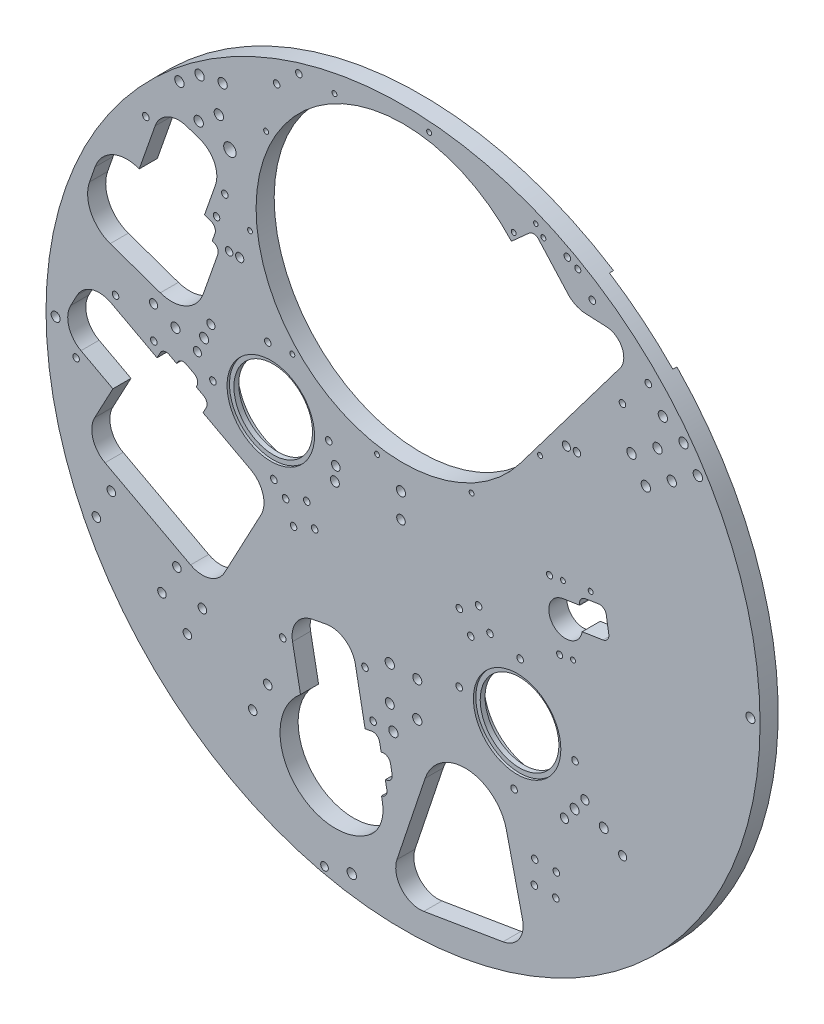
SolidWorks part; units mm, degrees
ref_plane "Front" through (0, 0, 0) normal (0, 0, 1) x (1, 0, 0)
ref_plane "Top" through (0, 0, 0) normal (0, 1, 0) x (1, 0, 0)
ref_plane "Right" through (0, 0, 0) normal (1, 0, 0) x (0, 0, -1)
sketch "Sketch1" plane through (0, 0, 0) normal (0, 0, 1) x (1, 0, 0)
  circle A0 centre (0, 0) radius 187.96
  dimension "D1" = 375.92
extrude ".375 base" add sketch "Sketch1" along normal blind 9.525
sketch "Sketch2" plane through (0, 0, 0) normal (0, 0, -1) x (-1, 0, 0)
  line L0 (0, 102.108) -> (2.8248, 24.7908) construction
  line L1 (-106.6865, 130.8873) -> (-100.7163, 123.4771) construction
  line L2 (-114.2842, 125.1577) -> (-61.7729, 55.5243)
  line L3 (-57.0751, 154.3418) -> (-68.2654, 142.1143)
  line L5 (-107.1075, 140.394) -> (-68.2654, 142.1143)
  arc A0 (-61.7729, 55.5243) -> (-57.0751, 154.3418) centre (0, 102.108) ccw
  arc A3 (-107.1075, 140.394) -> (-114.2842, 125.1577) centre (-106.6865, 130.8873) ccw
  point P3 (2.7877, 25.8061)
  point P13 (-101.3537, 124.2682)
  dimension "D1" = 1.016
  dimension "D3" = 135
  dimension "D4" = 77.3688
  dimension "D5" = 9.516
  dimension "D6" = 102.108
  dimension "D10" = 57.0751
  dimension "D2" = 1.016
  dimension "D7" = 106.6865
  dimension "D8" = 28.7793
  dimension "D9" = 168.8594
  dimension "D11" = 77.3172
  dimension "D12" = 5.3327
extrude "carosel" cut sketch "Sketch2" against normal through all
sketch "Sketch5" plane through (0, 0, 0) normal (0, 0, -1) x (-1, 0, 0)
  circle A0 centre (69.6168, 13.7234) radius 20.701
  circle A2 centre (-60.0464, -64.1854) radius 20.701
  dimension "D1" = 41.402
  dimension "D3" = 69.6168
  dimension "D4" = 13.7234
  dimension "D5" = 60.0464
  dimension "D6" = 64.1854
extrude "heater" cut sketch "Sketch5" against normal through all
sketch "Sketch8" plane through (0, 0, 0) normal (0, 0, -1) x (-1, 0, 0)
  circle A0 centre (69.6168, 13.7234) radius 27.0002
  circle A1 centre (69.6168, 13.7234) radius 20.701 construction
  circle A2 centre (-60.0464, -64.1854) radius 27.0002
  circle A3 centre (-60.0464, -64.1854) radius 20.701 construction
  dimension "D1" = 54.0004
extrude "heater seal" cut sketch "Sketch8" against normal blind 5.715
hole_wizard "#8-32 for heaters" positions "Sketch19" profile "Sketch18" tap size "#8-32" standard "Ansi Inch"
sketch "Sketch19" plane through (0, 0, 9.525) normal (0, 0, 1) x (1, 0, 0)
  line L0 (60.0464, -64.1854) -> (60.0464, -20.8608) construction
  line L2 (60.0464, -64.1854) -> (61.6444, -33.6944) construction
  circle A10 centre (60.0464, -64.1854) radius 27.0002 construction
  point P0 (-100.1078, 12.1254)
  point P1 (-68.0188, -16.7676)
  point P2 (-71.2148, 44.2144)
  point P3 (-39.1258, 15.3214)
  point P10 (29.5554, -62.5874)
  point P11 (58.4485, -94.6764)
  point P14 (90.5374, -65.7834)
  point P15 (61.6444, -33.6944)
  dimension "D1" = 39.1258
  dimension "D2" = 15.3214
  dimension "D3" = 44.2144
  dimension "D4" = 71.2148
  dimension "D5" = 100.1078
  dimension "D6" = 12.1254
  dimension "D7" = 16.7676
  dimension "D8" = 68.0188
  dimension "D9" = 3
  dimension "D10" = 30.5329
  dimension "D11" = 30.491
  dimension "D12" = 1.598
  dimension "D13" = 30.491
  dimension "D14" = 1.598
  dimension "D15" = 30.491
  dimension "D16" = 1.598
sketch "Sketch18" plane through (-100.1078, 12.1254, 9.525) normal (1, 0, 0) x (0, -1, 0)
  line L0 (0, 0) -> (0, 9.525)
  line L1 (0, 9.525) -> (1.7272, 9.525)
  line L2 (1.7272, 9.525) -> (1.7272, 0)
  line L5 (1.7272, 0) -> (0, 0)
  line L11 (0, -6.35) -> (0, 107.95) construction
  dimension "Thru Tap Drill Dia." = 3.4544
  dimension "Thru Tap Drill Depth" = 9.525
sketch "Sketch9" plane through (0, 0, 9.525) normal (0, 0, 1) x (1, 0, 0)
  circle A0 centre (-69.6168, 13.7234) radius 23.0251
  circle A1 centre (-69.6168, 13.7234) radius 20.701 construction
  circle A2 centre (60.0464, -64.1854) radius 23.0251
  circle A3 centre (60.0464, -64.1854) radius 20.701 construction
  dimension "D1" = 46.0502
extrude "Sample heater bore" cut sketch "Sketch9" against normal blind 1.27
hole_wizard "3/16 for clamps" positions "Sketch15" profile "Sketch14" hole size "3/16" standard "Ansi Inch"
sketch "Sketch15" plane through (0, 0, 9.525) normal (0, 0, 1) x (1, 0, 0)
  point P0 (-104.7245, 29.3544)
  point P1 (-119.8109, 26.5067)
  point P6 (90.3338, -87.8485)
  point P7 (105.6609, -88.7352)
  dimension "D1" = 104.7245
  dimension "D2" = 29.3544
  dimension "D3" = 26.5067
  dimension "D4" = 119.8109
  dimension "D5" = 90.3338
  dimension "D6" = 105.6609
  dimension "D7" = 88.7352
  dimension "D8" = 87.8485
sketch "Sketch14" plane through (-104.7245, 29.3544, 9.525) normal (1, 0, 0) x (0, -1, 0)
  line L0 (0, 0) -> (0, 9.525)
  line L1 (0, 9.525) -> (2.3749, 9.525)
  line L2 (2.3749, 9.525) -> (2.3749, 0)
  line L5 (2.3749, 0) -> (0, 0)
  line L11 (0, -6.35) -> (0, 107.95) construction
  dimension "Thru Hole Dia." = 4.7498
  dimension "Thru Hole Depth" = 9.525
hole_wizard "#18 for clamps" positions "Sketch17" profile "Sketch16" hole size "#18" standard "Ansi Inch"
sketch "Sketch17" plane through (0, 0, 9.525) normal (0, 0, 1) x (1, 0, 0)
  point P0 (-101.1706, 37.3366)
  point P1 (-131.3433, 31.6413)
  point P2 (-108.2784, 21.3722)
  point P9 (84.9544, -94.7338)
  point P10 (95.7132, -80.9632)
  point P11 (115.6086, -96.5072)
  dimension "D1" = 101.1706
  dimension "D2" = 108.2784
  dimension "D3" = 131.3433
  dimension "D4" = 37.3366
  dimension "D5" = 21.3722
  dimension "D6" = 31.6413
  dimension "D7" = 84.9544
  dimension "D8" = 95.7132
  dimension "D9" = 115.6086
  dimension "D10" = 80.9632
  dimension "D11" = 94.7338
  dimension "D12" = 96.5072
sketch "Sketch16" plane through (-101.1706, 37.3366, 9.525) normal (1, 0, 0) x (0, -1, 0)
  line L0 (0, 0) -> (0, 9.525)
  line L1 (0, 9.525) -> (2.1526, 9.525)
  line L2 (2.1526, 9.525) -> (2.1526, 0)
  line L5 (2.1526, 0) -> (0, 0)
  line L11 (0, -6.35) -> (0, 107.95) construction
  dimension "Thru Hole Dia." = 4.3053
  dimension "Thru Hole Depth" = 9.525
sketch "Sketch20" plane through (0, 0, 0) normal (0, 0, -1) x (-1, 0, 0)
  circle A0 centre (182.88, 0) radius 2.3749
  circle A2 centre (-182.88, 0) radius 2.3749
  dimension "D1" = 4.7498
  dimension "D5" = 4.7498
  dimension "D4" = 182.88
  dimension "D6" = 182.88
extrude "locating pins - fabrication" cut sketch "Sketch20" against normal through all
sketch "Sketch29" plane through (0, 0, 0) normal (0, 0, -1) x (-1, 0, 0)
  line L0 (-75.6506, 127.7436) -> (-54.1018, 151.676)
  line L1 (-54.1018, 151.676) -> (-68.9675, 165.0611)
  line L2 (-68.9675, 165.0611) -> (-90.5163, 141.1288)
  line L3 (-75.6506, 127.7436) -> (-90.5163, 141.1288)
  line L5 (0, 0) -> (0, 172.265) construction
  line L6 (-68.2654, 142.1143) -> (-107.1075, 140.394) construction
  dimension "D1" = 32.2042
  dimension "D2" = 151.676
  dimension "D3" = 20.0038
  dimension "D4" = 54.1018
extrude "carousel hall sensor" cut sketch "Sketch29" against normal through all
fillet "Fillet3" radius 3.556 1 edges at (68.9675, 165.0611, 4.7625)
hole_wizard "#5-40 Tapped Hole1" positions "Sketch31" profile "Sketch30" tap size "#5-40" standard "Ansi Inch"
sketch "Sketch31" plane through (0, 0, 0) normal (0, 0, -1) x (-1, 0, 0)
  point P0 (-73.8764, 164.3542)
  dimension "D1" = 164.3542
  dimension "D2" = 73.8764
sketch "Sketch30" plane through (73.8764, 164.3542, 0) normal (1, 0, 0) x (0, 1, 0)
  line L0 (0, 0) -> (0, 9.525)
  line L1 (0, 9.525) -> (1.289, 9.525)
  line L2 (1.289, 9.525) -> (1.289, 0)
  line L5 (1.289, 0) -> (0, 0)
  line L11 (0, -6.35) -> (0, 107.95) construction
  dimension "Thru Tap Drill Dia." = 2.5781
  dimension "Thru Tap Drill Depth" = 9.525
hole_wizard "3/32 (0.093750) Diameter Hole1" positions "Sketch33" profile "Sketch32" hole size "3/32" standard "Ansi Inch"
sketch "Sketch33" plane through (0, 0, 0) normal (0, 0, -1) x (-1, 0, 0)
  point P0 (-69.8824, 168.7901)
  dimension "D1" = 69.8824
  dimension "D2" = 168.7901
sketch "Sketch32" plane through (69.8824, 168.7901, 0) normal (1, 0, 0) x (0, 1, 0)
  line L0 (0, 0) -> (0, 9.525)
  line L1 (0, 9.525) -> (1.1913, 9.525)
  line L2 (1.1913, 9.525) -> (1.1913, 0)
  line L5 (1.1913, 0) -> (0, 0)
  line L11 (0, -6.35) -> (0, 107.95) construction
  dimension "Thru Hole Dia." = 2.3825
  dimension "Thru Hole Depth" = 9.525
hole_wizard "#5-40 Tapped Hole2" positions "Sketch39" profile "Sketch38" tap size "#5-40" standard "Ansi Inch"
sketch "Sketch39" plane through (0, 0, 9.525) normal (0, 0, 1) x (1, 0, 0)
  point P0 (36.0788, 29.108)
  point P3 (58.2781, 158.9793)
  point P4 (13.7199, 182.3728)
  point P5 (-36.0788, 175.108)
  point P8 (-13.7199, 21.8432)
  point P9 (-72.0967, 139.9596)
  point P10 (-80.5761, 90.3532)
  point P11 (-58.2781, 45.2367)
  point P12 (72.0967, 64.2564)
  dimension "D1" = 13.7199
  dimension "D2" = 58.2781
  dimension "D3" = 36.0788
  dimension "D4" = 72.0967
  dimension "D5" = 80.5761
  dimension "D6" = 72.0967
  dimension "D7" = 36.0788
  dimension "D8" = 13.7199
  dimension "D9" = 58.2781
  dimension "D10" = 158.9793
  dimension "D11" = 182.3728
  dimension "D12" = 64.2564
  dimension "D13" = 29.108
  dimension "D14" = 21.8432
  dimension "D15" = 45.2367
  dimension "D16" = 90.3532
  dimension "D17" = 139.9596
  dimension "D18" = 175.108
sketch "Sketch38" plane through (36.0788, 29.108, 9.525) normal (1, 0, 0) x (0, -1, 0)
  line L0 (0, 0) -> (0, 9.525)
  line L1 (0, 9.525) -> (1.289, 9.525)
  line L2 (1.289, 9.525) -> (1.289, 0)
  line L5 (1.289, 0) -> (0, 0)
  line L11 (0, -6.35) -> (0, 107.95) construction
  dimension "Thru Tap Drill Dia." = 2.5781
  dimension "Thru Tap Drill Depth" = 9.525
fillet "Fillet6" radius 13.208 1 edges at (90.5163, 141.1288, 4.7625)
sketch "Sketch41" plane through (0, 0, 0) normal (0, 0, -1) x (-1, 0, 0)
  line L0 (-106.6865, 130.8873) -> (-109.7316, 103.0754) construction
  circle A0 centre (-106.6865, 130.8873) radius 27.9781
  point P4 (-109.7274, 103.1133)
  dimension "D2" = 55.9562
  dimension "D5" = 130.8873
  dimension "D1" = 0.0381
  dimension "D3" = 106.6865
  dimension "D4" = 27.8119
extrude "carousel drive" cut sketch "Sketch41" against normal blind 2.159
hole_wizard "#8-32 Tapped Hole2" positions "Sketch43" profile "Sketch42" tap size "#8-32" standard "Ansi Inch"
sketch "Sketch43" plane through (0, 0, 2.159) normal (0, 0, -1) x (-1, 0, 0)
  point P0 (-99.6461, 148.7604)
  point P9 (-129.0854, 125.5098)
  point P10 (-115.5017, 109.6054)
  dimension "D1" = 148.7604
  dimension "D2" = 125.5098
  dimension "D3" = 109.6054
  dimension "D4" = 115.5017
  dimension "D5" = 129.0854
  dimension "D6" = 99.6461
sketch "Sketch42" plane through (99.6461, 148.7604, 2.159) normal (1, 0, 0) x (0, 1, 0)
  line L0 (0, 0) -> (0, 7.366)
  line L1 (0, 7.366) -> (1.7272, 7.366)
  line L2 (1.7272, 7.366) -> (1.7272, 0)
  line L5 (1.7272, 0) -> (0, 0)
  line L11 (0, -6.35) -> (0, 107.95) construction
  dimension "Thru Tap Drill Dia." = 3.4544
  dimension "Thru Tap Drill Depth" = 7.366
hole_wizard "1/8 (0.125000) Diameter Hole1" positions "Sketch45" profile "Sketch44" hole size "1/8" standard "Ansi Inch"
sketch "Sketch45" plane through (0, 0, 0) normal (0, 0, -1) x (-1, 0, 0)
  point P0 (-91.9924, 159.1779)
  dimension "D1" = 91.9924
  dimension "D2" = 159.1779
sketch "Sketch44" plane through (91.9924, 159.1779, 0) normal (1, 0, 0) x (0, 1, 0)
  line L0 (0, 0) -> (0, 9.525)
  line L1 (0, 9.525) -> (1.5837, 9.525)
  line L2 (1.5837, 9.525) -> (1.5837, 0)
  line L5 (1.5837, 0) -> (0, 0)
  line L11 (0, -6.35) -> (0, 107.95) construction
  dimension "Thru Hole Dia." = 3.1674
  dimension "Thru Hole Depth" = 9.525
hole_wizard "#8-32 Tapped Hole3" positions "Sketch47" profile "Sketch46" tap size "#8-32" standard "Ansi Inch"
sketch "Sketch47" plane through (0, 0, 0) normal (0, 0, -1) x (-1, 0, 0)
  point P0 (-86.4987, 161.8352)
  dimension "D1" = 86.4987
  dimension "D2" = 161.8352
sketch "Sketch46" plane through (86.4987, 161.8352, 0) normal (1, 0, 0) x (0, 1, 0)
  line L0 (0, 0) -> (0, 9.525)
  line L1 (0, 9.525) -> (1.7272, 9.525)
  line L2 (1.7272, 9.525) -> (1.7272, 0)
  line L5 (1.7272, 0) -> (0, 0)
  line L11 (0, -6.35) -> (0, 107.95) construction
  dimension "Thru Tap Drill Dia." = 3.4544
  dimension "Thru Tap Drill Depth" = 9.525
hole_wizard "collection rotary valve - TOP" positions "Sketch49" profile "Sketch48" tap size "#8-32" standard "Ansi Inch"
sketch "Sketch49" plane through (0, 0, 9.525) normal (0, 0, 1) x (1, 0, 0)
  point P0 (-86.5559, -109.9422)
  point P1 (-84.4318, -89.7335)
  dimension "D1" = 84.4318
  dimension "D2" = 86.5559
  dimension "D3" = 109.9422
  dimension "D4" = 89.7335
sketch "Sketch48" plane through (-86.5559, -109.9422, 9.525) normal (1, 0, 0) x (0, -1, 0)
  line L0 (0, 0) -> (0, 9.525)
  line L1 (0, 9.525) -> (1.7272, 9.525)
  line L2 (1.7272, 9.525) -> (1.7272, 0)
  line L5 (1.7272, 0) -> (0, 0)
  line L11 (0, -6.35) -> (0, 107.95) construction
  dimension "Thru Tap Drill Dia." = 3.4544
  dimension "Thru Tap Drill Depth" = 9.525
sketch "Sketch50" plane through (0, 0, 0) normal (0, 0, -1) x (-1, 0, 0)
  line L0 (106.8708, 118.8518) -> (113.7025, 121.2459)
  line L2 (130.5354, 113.1494) -> (138.8718, 89.3618)
  line L3 (98.7743, 102.0188) -> (104.5287, 85.5989)
  line L4 (104.5287, 85.5989) -> (101.1728, 84.4228)
  line L5 (98.993, 79.8909) -> (100.421, 75.8159)
  line L6 (100.421, 75.8159) -> (99.7019, 75.5639)
  line L7 (97.5221, 71.0319) -> (105.1245, 49.3385)
  line L8 (0, 0) -> (0, 132.8162) construction
  line L9 (165.0511, 70.3397) -> (162.1309, 78.6727)
  line L10 (139.4711, 89.5718) -> (138.8718, 89.3618)
  line L24 (127.7843, 38.4393) -> (154.152, 47.6799)
  arc A0 (154.152, 47.6799) -> (165.0511, 70.3397) centre (148.2717, 64.4593) ccw
  arc A1 (127.7843, 38.4393) -> (105.1245, 49.3385) centre (121.904, 55.2188) cw
  arc A2 (130.5354, 113.1494) -> (113.7025, 121.2459) centre (118.0707, 108.7812) ccw
  arc A3 (106.8708, 118.8518) -> (98.7743, 102.0188) centre (111.2391, 106.387) ccw
  arc A4 (98.993, 79.8909) -> (101.1728, 84.4228) centre (102.3488, 81.0669) cw
  arc A5 (162.1309, 78.6727) -> (139.4711, 89.5718) centre (145.3514, 72.7923) ccw
  arc A6 (97.5221, 71.0319) -> (99.7019, 75.5639) centre (100.878, 72.208) cw
  circle A10 centre (0, 0) radius 187.96 construction
  dimension "D2" = 13.208
  dimension "D3" = 3.556
  dimension "D12" = 13.208
  dimension "D14" = 82.804
  dimension "D15" = 7.874
  dimension "D13" = 30.607
  dimension "D9" = 17.78
  dimension "D11" = 3.556
  dimension "D7" = 7.62
  dimension "D6" = 33.655
  dimension "D4" = 121.904
  dimension "D5" = 55.2188
  dimension "D8" = 7.112
  dimension "D10" = 11.43
  dimension "D16" = 63.5
  dimension "D17" = 19.313
extrude "Internal Sampler" cut sketch "Sketch50" against normal through all
hole_wizard "#8-32 Tapped Hole (Syringes)" positions "Sketch52" profile "Sketch51" tap size "#8-32" standard "Ansi Inch"
sketch "Sketch52" plane through (0, 0, 0) normal (0, 0, -1) x (-1, 0, 0)
  point P0 (151.3542, 25.516)
  point P1 (131.1888, 14.7486)
  point P2 (63.3203, -86.6623)
  point P3 (93.8184, 100.4166)
  point P4 (135.4074, 114.9914)
  point P5 (15.7468, -100.8545)
  point P6 (20.0328, -78.3999)
  point P7 (172.1113, -13.3585)
  point P19 (98.1866, 87.9518)
  dimension "D1" = 114.9914
  dimension "D2" = 100.4166
  dimension "D3" = 87.9518
  dimension "D4" = 25.516
  dimension "D5" = 14.7486
  dimension "D6" = 13.3585
  dimension "D7" = 172.1113
  dimension "D8" = 131.1888
  dimension "D9" = 151.3542
  dimension "D10" = 98.1866
  dimension "D11" = 93.8184
  dimension "D12" = 135.4074
  dimension "D13" = 78.3999
  dimension "D14" = 100.8545
  dimension "D15" = 86.6623
  dimension "D16" = 20.0328
  dimension "D17" = 15.7468
  dimension "D18" = 63.3203
sketch "Sketch51" plane through (-151.3542, 25.516, 0) normal (1, 0, 0) x (0, 1, 0)
  line L0 (0, 0) -> (0, 9.525)
  line L1 (0, 9.525) -> (1.7272, 9.525)
  line L2 (1.7272, 9.525) -> (1.7272, 0)
  line L5 (1.7272, 0) -> (0, 0)
  line L11 (0, -6.35) -> (0, 107.95) construction
  dimension "Thru Tap Drill Dia." = 3.4544
  dimension "Thru Tap Drill Depth" = 9.525
hole_wizard "#5 C'bore valve mounting" positions "Sketch54" profile "Sketch53" counterbore size "#5" standard "Ansi Inch"
sketch "Sketch54" plane through (0, 0, 0) normal (0, 0, -1) x (-1, 0, 0)
  point P0 (61.7947, -22.4206)
  point P1 (50.6874, -18.0453)
  point P6 (57.6358, -32.9787)
  point P9 (46.5284, -28.6034)
  point P12 (-35.6446, -36.3983)
  point P13 (-29.6312, -26.7749)
  point P14 (-39.7552, -20.4487)
  point P15 (-45.7686, -30.0721)
  point P24 (-80.6667, -121.4168)
  point P25 (-69.3207, -121.2188)
  point P26 (-80.4584, -133.353)
  point P27 (-69.1124, -133.155)
  dimension "D1" = 29.6312
  dimension "D2" = 39.7552
  dimension "D3" = 35.6446
  dimension "D4" = 45.7686
  dimension "D5" = 26.7749
  dimension "D6" = 20.4487
  dimension "D7" = 30.0721
  dimension "D8" = 36.3983
  dimension "D9" = 18.0453
  dimension "D10" = 22.4206
  dimension "D11" = 28.6034
  dimension "D12" = 32.9787
  dimension "D13" = 50.6874
  dimension "D14" = 61.7947
  dimension "D15" = 46.5284
  dimension "D16" = 57.6358
  dimension "D17" = 121.2188
  dimension "D18" = 121.4168
  dimension "D19" = 133.353
  dimension "D20" = 133.155
  dimension "D21" = 69.3207
  dimension "D22" = 69.1124
  dimension "D23" = 80.4584
  dimension "D24" = 80.6667
sketch "Sketch53" plane through (-61.7947, -22.4206, 0) normal (1, 0, 0) x (0, 1, 0)
  line L0 (0, 0) -> (0, 9.525)
  line L1 (0, 9.525) -> (1.7272, 9.525)
  line L3 (1.7272, 9.525) -> (1.7272, 5.08)
  line L4 (1.7272, 5.08) -> (3.175, 5.08)
  line L5 (3.175, 5.08) -> (3.175, 0)
  line L7 (3.175, 0) -> (0, 0)
  line L11 (0, -6.35) -> (0, 107.95) construction
  dimension "Thru Hole Dia." = 3.4544
  dimension "Thru Hole Depth" = 9.525
  dimension "C'Bore Dia." = 6.35
  dimension "C'Bore Depth" = 5.08
hole_wizard "3/16 (0.187500) Diameter Hole2" positions "Sketch56" profile "Sketch55" hole size "3/16" standard "Ansi Inch"
sketch "Sketch56" plane through (0, 0, 9.525) normal (0, 0, 1) x (1, 0, 0)
  point P0 (-6.985, -88.392)
  point P1 (7.493, -70.104)
  dimension "D1" = 70.104
  dimension "D2" = 88.392
  dimension "D3" = 6.985
  dimension "D4" = 7.493
sketch "Sketch55" plane through (-6.985, -88.392, 9.525) normal (1, 0, 0) x (0, -1, 0)
  line L0 (0, 0) -> (0, 9.525)
  line L1 (0, 9.525) -> (2.3749, 9.525)
  line L2 (2.3749, 9.525) -> (2.3749, 0)
  line L5 (2.3749, 0) -> (0, 0)
  line L11 (0, -6.35) -> (0, 107.95) construction
  dimension "Thru Hole Dia." = 4.7498
  dimension "Thru Hole Depth" = 9.525
hole_wizard "#10 (0.193500) Diameter Hole2" positions "Sketch58" profile "Sketch57" hole size "#10" standard "Ansi Inch"
sketch "Sketch58" plane through (0, 0, 9.525) normal (0, 0, 1) x (1, 0, 0)
  point P0 (7.493, -88.392)
  point P1 (-6.985, -70.104)
  dimension "D1" = 6.985
  dimension "D2" = 7.493
  dimension "D3" = 70.104
  dimension "D4" = 88.392
sketch "Sketch57" plane through (7.493, -88.392, 9.525) normal (1, 0, 0) x (0, -1, 0)
  line L0 (0, 0) -> (0, 9.525)
  line L1 (0, 9.525) -> (2.4574, 9.525)
  line L2 (2.4574, 9.525) -> (2.4574, 0)
  line L5 (2.4574, 0) -> (0, 0)
  line L11 (0, -6.35) -> (0, 107.95) construction
  dimension "Thru Hole Dia." = 4.9149
  dimension "Thru Hole Depth" = 9.525
hole_wizard "CBORE for #8 Socket Head Cap Screw1" positions "Sketch60" profile "Sketch59" counterbore size "#8" standard "Ansi Inch"
sketch "Sketch60" plane through (0, 0, 0) normal (0, 0, -1) x (-1, 0, 0)
  point P0 (35.3733, 5.7574)
  point P1 (1.0833, -1.634)
  dimension "D1" = 1.0833
  dimension "D2" = 35.3733
  dimension "D3" = 5.7574
  dimension "D4" = 1.634
sketch "Sketch59" plane through (-35.3733, 5.7574, 0) normal (1, 0, 0) x (0, 1, 0)
  line L0 (0, 0) -> (0, 9.525)
  line L1 (0, 9.525) -> (2.2606, 9.525)
  line L3 (2.2606, 9.525) -> (2.2606, 5.08)
  line L4 (2.2606, 5.08) -> (3.683, 5.08)
  line L5 (3.683, 5.08) -> (3.683, 0)
  line L7 (3.683, 0) -> (0, 0)
  line L11 (0, -6.35) -> (0, 107.95) construction
  dimension "Thru Hole Dia." = 4.5212
  dimension "Thru Hole Depth" = 9.525
  dimension "C'Bore Dia." = 7.366
  dimension "C'Bore Depth" = 5.08
hole_wizard "3/16 (0.187500) Diameter Hole3" positions "Sketch62" profile "Sketch61" hole size "3/16" standard "Ansi Inch"
sketch "Sketch62" plane through (0, 0, 0) normal (0, 0, -1) x (-1, 0, 0)
  point P0 (1.0833, 11.32)
  point P1 (35.894, -1.634)
  dimension "D1" = 11.32
  dimension "D2" = 1.634
  dimension "D3" = 35.894
  dimension "D4" = 1.0833
sketch "Sketch61" plane through (-1.0833, 11.32, 0) normal (1, 0, 0) x (0, 1, 0)
  line L0 (0, 0) -> (0, 9.525)
  line L1 (0, 9.525) -> (2.3749, 9.525)
  line L2 (2.3749, 9.525) -> (2.3749, 0)
  line L5 (2.3749, 0) -> (0, 0)
  line L11 (0, -6.35) -> (0, 107.95) construction
  dimension "Thru Hole Dia." = 4.7498
  dimension "Thru Hole Depth" = 9.525
hole_wizard "#8-32 Tapped Hole5" positions "Sketch64" profile "Sketch63" tap size "#8-32" standard "Ansi Inch"
sketch "Sketch64" plane through (0, 0, 0) normal (0, 0, -1) x (-1, 0, 0)
  point P0 (66.5694, 164.2733)
  point P1 (54.8664, 174.8108)
  dimension "D1" = 174.8108
  dimension "D2" = 164.2733
  dimension "D3" = 66.5694
  dimension "D4" = 54.8664
sketch "Sketch63" plane through (-66.5694, 164.2733, 0) normal (1, 0, 0) x (0, 1, 0)
  line L0 (0, 0) -> (0, 9.525)
  line L1 (0, 9.525) -> (1.7272, 9.525)
  line L2 (1.7272, 9.525) -> (1.7272, 0)
  line L5 (1.7272, 0) -> (0, 0)
  line L11 (0, -6.35) -> (0, 107.95) construction
  dimension "Thru Tap Drill Dia." = 3.4544
  dimension "Thru Tap Drill Depth" = 9.525
hole_wizard "#18 (0.169500) Diameter Hole4" positions "Sketch66" profile "Sketch65" hole size "#18" standard "Ansi Inch"
sketch "Sketch66" plane through (0, 0, 0) normal (0, 0, -1) x (-1, 0, 0)
  point P0 (85.979, 75.438)
  point P1 (-85.979, 75.438)
  point P14 (-11.7545, -2.621)
  dimension "D1" = 85.979
  dimension "D2" = 85.979
  dimension "D3" = 75.438
  dimension "D4" = 75.438
sketch "Sketch65" plane through (-85.979, 75.438, 0) normal (1, 0, 0) x (0, 1, 0)
  line L0 (0, 0) -> (0, 9.525)
  line L1 (0, 9.525) -> (2.1526, 9.525)
  line L2 (2.1526, 9.525) -> (2.1526, 0)
  line L5 (2.1526, 0) -> (0, 0)
  line L11 (0, -6.35) -> (0, 107.95) construction
  dimension "Thru Hole Dia." = 4.3053
  dimension "Thru Hole Depth" = 9.525
hole_wizard "5/32 (0.156250) Diameter Hole1" positions "Sketch68" profile "Sketch67" hole size "5/32" standard "Ansi Inch"
sketch "Sketch68" plane through (0, 0, 0) normal (0, 0, -1) x (-1, 0, 0)
  point P0 (-91.567, 75.438)
  point P1 (91.567, 75.438)
  point P12 (-91.6974, -47.5768)
  dimension "D1" = 91.567
  dimension "D2" = 91.567
  dimension "D3" = 75.438
  dimension "D4" = 75.438
sketch "Sketch67" plane through (91.567, 75.438, 0) normal (1, 0, 0) x (0, 1, 0)
  line L0 (0, 0) -> (0, 9.525)
  line L1 (0, 9.525) -> (1.9812, 9.525)
  line L2 (1.9812, 9.525) -> (1.9812, 0)
  line L5 (1.9812, 0) -> (0, 0)
  line L11 (0, -6.35) -> (0, 107.95) construction
  dimension "Thru Hole Dia." = 3.9624
  dimension "Thru Hole Depth" = 9.525
hole_wizard "#10 (0.1935) Diameter Hole1" positions "Sketch70" profile "Sketch69" hole size "#10" standard "Ansi Inch"
sketch "Sketch70" plane through (0, 0, 0) normal (0, 0, -1) x (-1, 0, 0)
  point P0 (-136.7718, 114.3708)
  point P1 (94.994, 150.3643)
  dimension "D1" = 136.7718
  dimension "D2" = 114.3708
  dimension "D3" = 150.3643
  dimension "D4" = 94.994
sketch "Sketch69" plane through (136.7718, 114.3708, 0) normal (1, 0, 0) x (0, 1, 0)
  line L0 (0, 0) -> (0, 9.525)
  line L1 (0, 9.525) -> (2.4574, 9.525)
  line L2 (2.4574, 9.525) -> (2.4574, 0)
  line L5 (2.4574, 0) -> (0, 0)
  line L11 (0, -6.35) -> (0, 107.95) construction
  dimension "Thru Hole Dia." = 4.9149
  dimension "Thru Hole Depth" = 9.525
hole_wizard "CBORE for #8 Socket Head Cap Screw2" positions "Sketch72" profile "Sketch71" counterbore size "#8" standard "Ansi Inch"
sketch "Sketch72" plane through (0, 0, 0) normal (0, 0, -1) x (-1, 0, 0)
  point P0 (79.1247, -127.4885)
  point P1 (71.2052, -111.8539)
  point P2 (105.6466, -94.4078)
  point P3 (113.5662, -110.0424)
  point P4 (119.0719, -82.2125)
  point P5 (126.9198, -97.8832)
  point P6 (161.4408, -80.595)
  point P7 (153.5929, -64.9243)
  dimension "D1" = 71.2052
  dimension "D2" = 79.1247
  dimension "D3" = 105.6466
  dimension "D4" = 113.5662
  dimension "D5" = 119.0719
  dimension "D6" = 126.9198
  dimension "D7" = 161.4408
  dimension "D8" = 153.5929
  dimension "D9" = 64.9243
  dimension "D10" = 80.595
  dimension "D11" = 82.2125
  dimension "D12" = 97.8832
  dimension "D13" = 94.4078
  dimension "D14" = 110.0424
  dimension "D15" = 111.8539
  dimension "D16" = 127.4885
sketch "Sketch71" plane through (-79.1247, -127.4885, 0) normal (1, 0, 0) x (0, 1, 0)
  line L0 (0, 0) -> (0, 9.525)
  line L1 (0, 9.525) -> (2.2479, 9.525)
  line L3 (2.2479, 9.525) -> (2.2479, 5.842)
  line L4 (2.2479, 5.842) -> (3.9687, 5.842)
  line L5 (3.9687, 5.842) -> (3.9687, 0)
  line L7 (3.9687, 0) -> (0, 0)
  line L11 (0, -6.35) -> (0, 107.95) construction
  dimension "Thru Hole Dia." = 4.4958
  dimension "Thru Hole Depth" = 9.525
  dimension "C'Bore Dia." = 7.9375
  dimension "C'Bore Depth" = 5.842
hole_wizard "#10 (0.1935) Diameter Hole2" positions "Sketch74" profile "Sketch73" hole size "#10" standard "Ansi Inch"
sketch "Sketch74" plane through (0, 0, 0) normal (0, 0, -1) x (-1, 0, 0)
  point P0 (5.0678, -100.3389)
  dimension "D1" = 100.3389
  dimension "D2" = 5.0678
sketch "Sketch73" plane through (-5.0678, -100.3389, 0) normal (1, 0, 0) x (0, 1, 0)
  line L0 (0, 0) -> (0, 9.525)
  line L1 (0, 9.525) -> (2.4574, 9.525)
  line L2 (2.4574, 9.525) -> (2.4574, 0)
  line L5 (2.4574, 0) -> (0, 0)
  line L11 (0, -6.35) -> (0, 107.95) construction
  dimension "Thru Hole Dia." = 4.9149
  dimension "Thru Hole Depth" = 9.525
sketch "Sketch77" plane through (0, 0, 0) normal (0, 0, -1) x (-1, 0, 0)
  line L0 (-93.0087, 6.3956) -> (-92.9491, 6.772)
  line L1 (-93.0087, 6.3956) -> (-84.1669, 4.9952)
  line L3 (-105.344, -3.2917) -> (-94.2745, -5.0449)
  line L4 (-95.905, 10.8405) -> (-102.9294, 11.953)
  line L6 (-108.2999, 0.7768) -> (-106.9979, 8.9971)
  line L9 (0, 0) -> (-64.3755, 0) construction
  arc A0 (-94.2745, -5.0449) -> (-84.1669, 4.9952) centre (-85.5476, -3.7226) ccw
  arc A2 (-102.9294, 11.953) -> (-106.9979, 8.9971) centre (-103.4857, 8.4408) ccw
  arc A3 (-105.344, -3.2917) -> (-108.2999, 0.7768) centre (-104.7877, 0.2206) cw
  arc A4 (-92.9491, 6.772) -> (-95.905, 10.8405) centre (-96.4613, 7.3282) ccw
  dimension "D1" = 9
  dimension "D3" = 3.556
  dimension "D4" = 3.556
  dimension "D9" = 8.8265
  dimension "D6" = 23.176
  dimension "D2" = 85.5476
  dimension "D5" = 0.381
  dimension "D7" = 7.112
  dimension "D8" = 3.7226
  dimension "D10" = 11.4977
  dimension "D11" = 64.3755
extrude "flush puck holder" cut sketch "Sketch77" against normal through all
hole_wizard "#5-40 Tapped Hole3" positions "Sketch79" profile "Sketch78" tap size "#5-40" standard "Ansi Inch"
sketch "Sketch79" plane through (0, 0, 0) normal (0, 0, -1) x (-1, 0, 0)
  point P0 (-89.4642, -20.3324)
  point P1 (-84.1398, 13.2846)
  point P2 (-98.7517, 15.5989)
  dimension "D1" = 84.1398
  dimension "D2" = 98.7517
  dimension "D3" = 89.4642
  dimension "D4" = 20.3324
  dimension "D5" = 13.2846
  dimension "D6" = 15.5989
sketch "Sketch78" plane through (89.4642, -20.3324, 0) normal (1, 0, 0) x (0, 1, 0)
  line L0 (0, 0) -> (0, 9.525)
  line L1 (0, 9.525) -> (1.289, 9.525)
  line L2 (1.289, 9.525) -> (1.289, 0)
  line L5 (1.289, 0) -> (0, 0)
  line L11 (0, -6.35) -> (0, 107.95) construction
  dimension "Thru Tap Drill Dia." = 2.5781
  dimension "Thru Tap Drill Depth" = 9.525
hole_wizard "1/8 (0.125) Diameter Hole1" positions "Sketch81" profile "Sketch80" hole size "1/8" standard "Ansi Inch"
sketch "Sketch81" plane through (0, 0, 0) normal (0, 0, -1) x (-1, 0, 0)
  point P0 (-82.4398, -21.445)
  point P1 (-77.1154, 12.172)
  dimension "D1" = 77.1154
  dimension "D2" = 82.4398
  dimension "D3" = 21.445
  dimension "D4" = 12.172
sketch "Sketch80" plane through (82.4398, -21.445, 0) normal (1, 0, 0) x (0, 1, 0)
  line L0 (0, 0) -> (0, 9.525)
  line L1 (0, 9.525) -> (1.5837, 9.525)
  line L2 (1.5837, 9.525) -> (1.5837, 0)
  line L5 (1.5837, 0) -> (0, 0)
  line L11 (0, -6.35) -> (0, 107.95) construction
  dimension "Thru Hole Dia." = 3.1674
  dimension "Thru Hole Depth" = 9.525
sketch "Sketch87" plane through (0, 0, 0) normal (0, 0, -1) x (-1, 0, 0)
  line L0 (19.9805, -106.4464) -> (25.1236, -79.5009)
  line L1 (40.5738, -69.0034) -> (47.6844, -70.3607)
  line L2 (58.1818, -85.8108) -> (53.98, -107.8249)
  line L3 (19.9805, -106.4464) -> (16.4876, -105.7797)
  line L4 (6.6102, -115.5308) -> (5.753, -120.0217)
  line L6 (10.7699, -112.7045) -> (11.5183, -112.8474)
  line L7 (11.5183, -112.8474) -> (12.3279, -108.606)
  line L8 (8.5793, -124.1813) -> (9.3277, -124.3242)
  line L9 (9.3277, -124.3242) -> (8.5182, -128.5656)
  line L11 (11.3444, -132.7253) -> (10.8682, -135.2202)
  line L14 (0, 0) -> (0, -202.9001) construction
  arc A0 (18.2373, -154.0139) -> (53.98, -107.8249) centre (35.56, -130.4948) ccw
  arc A1 (40.5738, -69.0034) -> (25.1236, -79.5009) centre (38.0974, -81.9772) ccw
  arc A2 (8.5182, -128.5656) -> (11.3444, -132.7253) centre (12.0111, -129.2323) ccw
  arc A3 (16.4876, -105.7797) -> (12.3279, -108.606) centre (15.8209, -109.2727) ccw
  arc A4 (5.753, -120.0217) -> (8.5793, -124.1813) centre (9.246, -120.6884) ccw
  arc A5 (10.7699, -112.7045) -> (6.6102, -115.5308) centre (10.1031, -116.1975) ccw
  arc A6 (58.1818, -85.8108) -> (47.6844, -70.3607) centre (45.2081, -83.3344) ccw
  arc A7 (18.2373, -154.0139) -> (10.8682, -135.2202) centre (29.4651, -138.7699) cw
  point P26 (6.1816, -117.7762)
  dimension "D1" = 3.556
  dimension "D2" = 13.208
  dimension "D5" = 29.21
  dimension "D9" = 7.874
  dimension "D7" = 130.4948
  dimension "D3" = 27.432
  dimension "D4" = 33.655
  dimension "D6" = 11.43
  dimension "D8" = 40.64
  dimension "D10" = 10.806
  dimension "D11" = 35.56
  dimension "D12" = 7.112
  dimension "D13" = 11.684
  dimension "D14" = 38.0974
  dimension "D15" = 69.0034
  dimension "D17" = 2.54
extrude "processing syringe" cut sketch "Sketch87" against normal through all
sketch "Sketch88" plane through (0, 0, 0) normal (0, 0, -1) x (-1, 0, 0)
  line L0 (-11.644, -113.1652) -> (3.204, -157.6629)
  line L1 (-10.9376, -174.2088) -> (-52.615, -167.2395)
  line L2 (-62.8911, -151.8404) -> (-54.3751, -115.1721)
  arc A0 (-134.6635, 131.1285) -> (-101.2815, 158.3383) centre (0, 0) ccw construction
  arc A1 (-11.644, -113.1652) -> (-54.3751, -115.1721) centre (-32.7263, -120.1999) ccw
  arc A2 (-52.615, -167.2395) -> (-62.8911, -151.8404) centre (-50.5204, -154.7134) cw
  arc A3 (3.204, -157.6629) -> (-10.9376, -174.2088) centre (-8.843, -161.6827) cw
  point P14 (-66.4068, -164.9333)
  point P17 (10.5382, -177.8)
  dimension "D1" = 120.1999
  dimension "D3" = 10.16
  dimension "D5" = 12.7
  dimension "D4" = 32.7263
  dimension "D9" = 50.5204
  dimension "D10" = 22.225
  dimension "D2" = 10.16
  dimension "D6" = 161.6827
  dimension "D7" = 8.843
  dimension "D8" = 154.7134
extrude "precious reagent valve" cut sketch "Sketch88" against normal through all
sketch "Sketch40" plane through (0, 0, 0) normal (0, 0, -1) x (-1, 0, 0)
  line L0 (153.6948, 20.8629) -> (129.4963, 7.9421)
  line L1 (171.567, 15.4329) -> (174.9767, 9.0472)
  line L2 (169.5467, -8.8251) -> (152.7422, -17.7978)
  line L3 (119.2006, 10.5071) -> (123.0096, 12.5409)
  line L5 (114.0299, 12.6412) -> (109.9968, 10.4877)
  line L6 (103.6229, -1.8418) -> (105.2978, -4.9787)
  line L8 (127.8214, 11.079) -> (129.4963, 7.9421)
  line L12 (119.2006, 10.5071) -> (118.8417, 11.1792)
  line L13 (108.5349, 5.6759) -> (108.8938, 5.0038)
  line L14 (108.8938, 5.0038) -> (105.0848, 2.9699)
  line L15 (152.7422, -17.7978) -> (162.3131, -35.7226)
  line L17 (105.2978, -4.9787) -> (80.203, -18.378)
  line L25 (156.8831, -53.5949) -> (111.847, -77.6419)
  line L26 (74.773, -36.2503) -> (93.9748, -72.2119)
  arc A0 (103.6229, -1.8418) -> (105.0848, 2.9699) centre (106.7597, -0.1669) cw
  arc A1 (74.773, -36.2503) -> (80.203, -18.378) centre (86.4241, -30.0291) cw
  arc A2 (171.567, 15.4329) -> (153.6948, 20.8629) centre (159.9159, 9.2118) ccw
  arc A3 (114.0299, 12.6412) -> (118.8417, 11.1792) centre (115.7048, 9.5043) cw
  arc A4 (127.8214, 11.079) -> (123.0096, 12.5409) centre (124.6845, 9.4041) ccw
  arc A5 (109.9968, 10.4877) -> (108.5349, 5.6759) centre (111.6717, 7.3509) ccw
  arc A7 (169.5467, -8.8251) -> (174.9767, 9.0472) centre (163.3256, 2.8261) ccw
  arc A12 (111.847, -77.6419) -> (93.9748, -72.2119) centre (105.6259, -65.9908) cw
  arc A13 (156.8831, -53.5949) -> (162.3131, -35.7226) centre (150.662, -41.9438) ccw
  point P44 (112.0134, 11.5644)
  dimension "D8" = 153.6948
  dimension "D10" = 3.556
  dimension "D11" = 11.684
  dimension "D13" = 27.432
  dimension "D16" = 13.208
  dimension "D20" = 33.528
  dimension "D24" = 13.208
  dimension "D12" = 3.556
  dimension "D6" = 3.556
  dimension "D25" = 13.208
  dimension "D7" = 13.208
  dimension "D9" = 3.556
  dimension "D5" = 11.43
  dimension "D15" = 13.208
  dimension "D3" = 67.183
  dimension "D4" = 7.112
  dimension "D14" = 86.4241
  dimension "D17" = 30.0291
  dimension "D18" = 41.656
  dimension "D21" = 32.258
  dimension "D22" = 77.47
extrude "Collection syringe" cut sketch "Sketch40" against normal through all
hole_wizard "#10 (0.1935) Diameter Hole3" positions "Sketch90" profile "Sketch89" hole size "#10" standard "Ansi Inch"
sketch "Sketch90" plane through (0, 0, 9.525) normal (0, 0, 1) x (1, 0, 0)
  point P3 (155.1677, 96.5429)
  point P4 (147.6399, 107.7034)
  point P5 (141.4803, 87.3106)
  point P6 (133.9525, 98.4711)
  point P7 (127.7929, 78.0784)
  point P8 (120.2651, 89.2389)
  point P12 (-117.7399, 139.7672)
  point P13 (-107.5753, 126.7572)
  point P14 (-107.1317, 148.0553)
  point P15 (-96.9671, 135.0452)
  dimension "D1" = 120.2651
  dimension "D2" = 133.9525
  dimension "D3" = 147.6399
  dimension "D4" = 127.7929
  dimension "D5" = 141.4803
  dimension "D6" = 155.1677
  dimension "D7" = 78.0784
  dimension "D8" = 87.3106
  dimension "D9" = 96.5429
  dimension "D10" = 89.2389
  dimension "D11" = 98.4711
  dimension "D12" = 107.7034
  dimension "D13" = 107.5753
  dimension "D14" = 96.9671
  dimension "D15" = 107.1317
  dimension "D16" = 117.7399
  dimension "D17" = 139.7672
  dimension "D18" = 126.7572
  dimension "D19" = 148.0553
  dimension "D20" = 135.0452
sketch "Sketch89" plane through (155.1677, 96.5429, 9.525) normal (1, 0, 0) x (0, -1, 0)
  line L0 (0, 0) -> (0, 9.525)
  line L1 (0, 9.525) -> (2.4574, 9.525)
  line L2 (2.4574, 9.525) -> (2.4574, 0)
  line L5 (2.4574, 0) -> (0, 0)
  line L11 (0, -6.35) -> (0, 107.95) construction
  dimension "Thru Hole Dia." = 4.9149
  dimension "Thru Hole Depth" = 9.525
hole_wizard "F (0.257) Diameter Hole2" positions "Sketch92" profile "Sketch91" hole size "F" standard "Ansi Inch"
sketch "Sketch92" plane through (0, 0, 9.525) normal (0, 0, 1) x (1, 0, 0)
  point P0 (-91.1687, 122.0116)
  dimension "D1" = 122.0116
  dimension "D2" = 91.1687
sketch "Sketch91" plane through (-91.1687, 122.0116, 9.525) normal (1, 0, 0) x (0, -1, 0)
  line L0 (0, 0) -> (0, 9.525)
  line L1 (0, 9.525) -> (3.2639, 9.525)
  line L2 (3.2639, 9.525) -> (3.2639, 0)
  line L5 (3.2639, 0) -> (0, 0)
  line L11 (0, -6.35) -> (0, 107.95) construction
  dimension "Thru Hole Dia." = 6.5278
  dimension "Thru Hole Depth" = 9.525
sketch "Sketch93" plane through (0, 0, 0) normal (0, 0, 1) x (1, 0, 0)
  line L0 (-0.0254, 187.7441) -> (0, 187.7441)
  line L1 (0, 187.7441) -> (0, 187.6679)
  line L2 (187.6679, 0.0254) -> (187.6679, 0)
  line L3 (187.6679, 0) -> (187.7441, 0)
  line L4 (187.7441, 0.0254) -> (187.7441, 0)
  line L5 (0, 187.6679) -> (-0.0254, 187.6679)
  arc A1 (187.7441, 0.0254) -> (187.6679, 0.0254) centre (187.706, 0.0254) ccw
  circle A2 centre (0, 0) radius 187.96 construction
  arc A3 (-0.0254, 187.7441) -> (-0.0254, 187.6679) centre (-0.0254, 187.706) ccw
  dimension "D3" = 0.254
  dimension "D1" = 0.0762
  dimension "D2" = 0.0254
  dimension "D4" = 0.0254
  dimension "D5" = 0.0762
  dimension "D6" = 0.254
extrude "Cut-Extrude7" [suppressed] cut sketch "Sketch93" along normal blind 0.127
sketch "Sketch94" plane through (0, 0, 9.525) normal (0, 0, 1) x (1, 0, 0)
  line L0 (136.7718, 114.3708) -> (-94.994, 150.3643) construction
  line L1 (20.8889, 132.3676) -> (-31.8478, -207.2098) construction
  circle A0 centre (-27.0001, -175.9949) radius 2.4638
  dimension "D1" = 4.9276
  dimension "D2" = 178.054
extrude "Cut-Extrude8" cut sketch "Sketch94" against normal through all
hole_wizard "#10-32 Tapped Hole1" positions "3DSketch1" profile "Sketch95" tap size "#10-32" standard "Ansi Inch"
sketch3d "3DSketch1"
  point P0 (-41.3512, -179.832, 9.525)
sketch "Sketch95" plane through (-41.3512, -179.832, 9.525) normal (1, 0, 0) x (0, -1, 0)
  line L0 (0, 0) -> (0, 9.525)
  line L1 (0, 9.525) -> (2.0193, 9.525)
  line L2 (2.0193, 9.525) -> (2.0193, 0)
  line L5 (2.0193, 0) -> (0, 0)
  line L11 (0, -6.35) -> (0, 107.95) construction
  dimension "Thru Tap Drill Dia." = 4.0386
  dimension "Thru Tap Drill Depth" = 9.525
